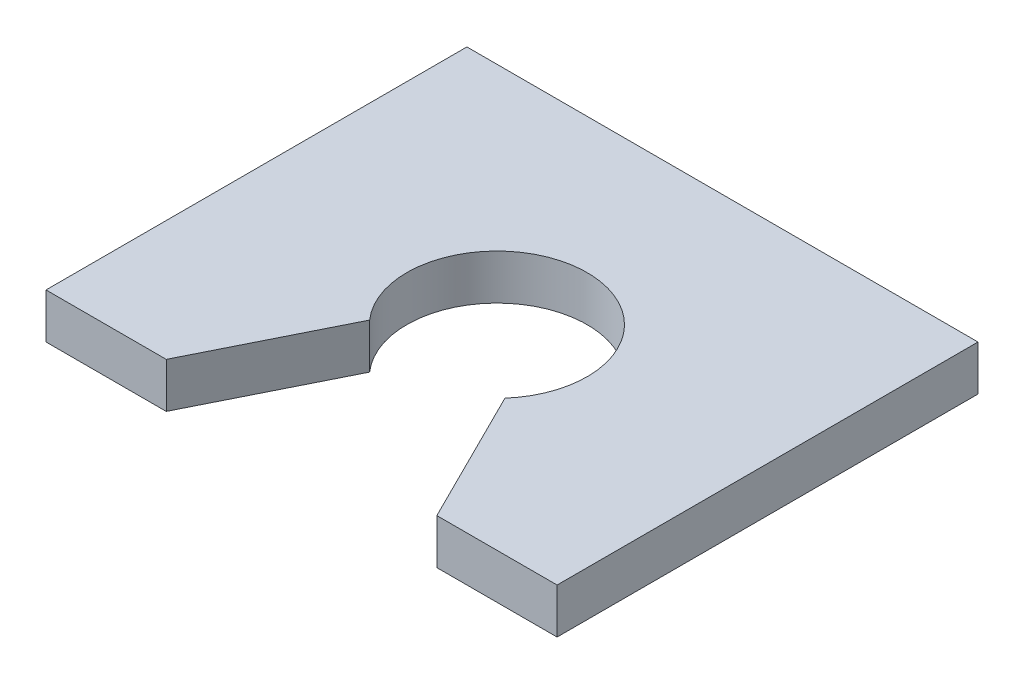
SolidWorks part; units mm, degrees
ref_plane "Front" through (0, 0, 0) normal (0, 0, 1) x (1, 0, 0)
ref_plane "Top" through (0, 0, 0) normal (0, 1, 0) x (1, 0, 0)
ref_plane "Right" through (0, 0, 0) normal (1, 0, 0) x (0, 0, -1)
sketch "Sketch1" plane through (0, 0, 0) normal (0, 1, 0) x (1, 0, 0)
  line L0 (26, 0) -> (34, 0)
  line L1 (0, 0) -> (8, 0)
  line L2 (0, 0) -> (0, 28)
  line L3 (0, 28) -> (34, 28)
  line L4 (34, 0) -> (34, 28)
  line L10 (12.5, 9.0314) -> (8, 0)
  line L11 (21.5, 9.0314) -> (26, 0)
  arc A0 (21.5, 9.0314) -> (12.5, 9.0314) centre (17, 13) ccw
  dimension "D1" = 15
  dimension "D4" = 6
  dimension "D2" = 18.9686
  dimension "D3" = 18.9686
  dimension "D5" = 28
extrude "Extrude1" add sketch "Sketch1" along normal blind 3
